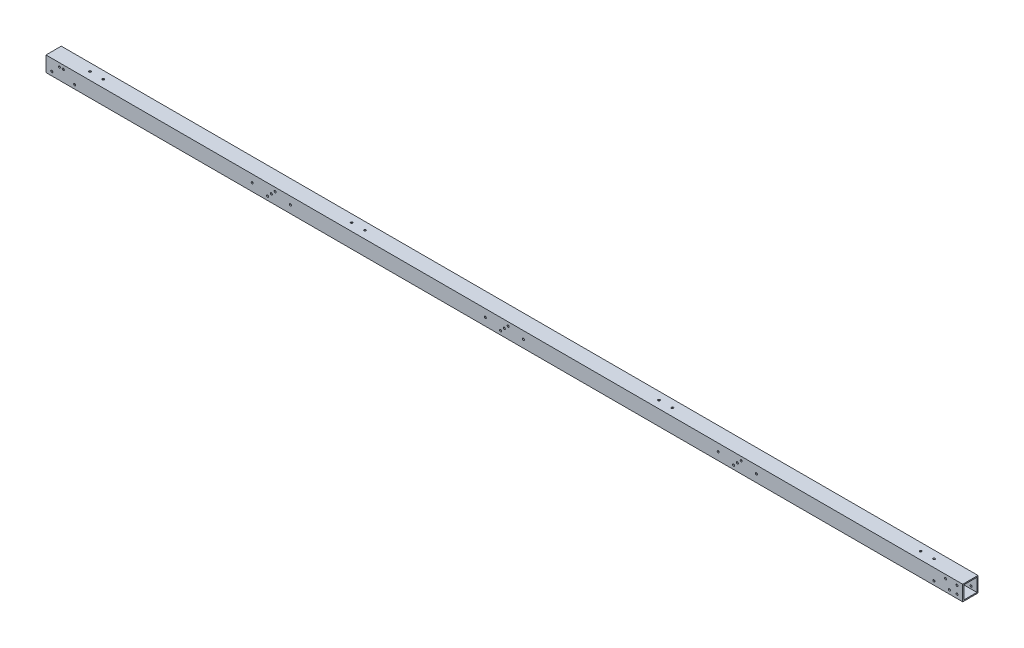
SolidWorks part; units mm, degrees
ref_plane "Front" through (0, 0, 0) normal (0, 0, 1) x (1, 0, 0)
ref_plane "Top" through (0, 0, 0) normal (0, 1, 0) x (1, 0, 0)
ref_plane "Right" through (0, 0, 0) normal (1, 0, 0) x (0, 0, -1)
sketch "Sketch1" plane through (0, 0, 0) normal (1, 0, 0) x (0, 0, -1)
  line L1 (0, 0) -> (50.8, 0)
  line L2 (0, 0) -> (0, 50.8)
  line L3 (0, 50.8) -> (50.8, 50.8)
  line L4 (50.8, 0) -> (50.8, 50.8)
  line L5 (3.6576, 47.1424) -> (47.1424, 47.1424)
  line L6 (3.6576, 47.1424) -> (3.6576, 3.6576)
  line L7 (3.6576, 3.6576) -> (47.1424, 3.6576)
  line L8 (47.1424, 47.1424) -> (47.1424, 3.6576)
  dimension "D1" = 50.8
  dimension "D2" = 50.8
  dimension "D3" = 3.6576
  dimension "D4" = 3.6576
  dimension "D5" = 3.6576
  dimension "D6" = 3.6576
extrude "Extrude1" add sketch "Sketch1" along normal blind 3048
sketch "Sketch3" plane through (0, 0, -50.8) normal (0, 0, -1) x (-1, 0, 0)
  line L5 (0, 0) -> (0, -664.0913) construction
  line L6 (0, -664.0913) -> (-3047.8384, -664.0913) construction
  line L7 (-3047.8384, 0) -> (-3047.8384, -664.0913) construction
  line L8 (-1523.9192, -664.0913) -> (-1523.9192, 171.6838) construction
  circle A0 centre (-95.6188, 12.3324) radius 3.3731
  circle A1 centre (-57.6849, 37.9799) radius 3.3731
  circle A2 centre (-3028.95, 12.7) radius 3.3731
  circle A4 centre (-19.4204, 12.8284) radius 3.3731
  circle A5 centre (-2952.2196, 12.3324) radius 3.3731
  circle A6 centre (-2990.85, 38.1) radius 3.3731
  point P0 (-3047.8384, 0)
extrude "Cut-Extrude2" cut sketch "Sketch3" against normal through all
sketch "Sketch4" plane through (0, 0, -50.8) normal (0, 0, -1) x (-1, 0, 0)
  circle A0 centre (-2235.1466, 25.4) radius 3.3731
  circle A1 centre (-2298.6466, 25.4) radius 3.3731
  circle A2 centre (-2362.1466, 25.4) radius 3.3731
  circle A3 centre (-812.7466, 25.4) radius 3.3731
  circle A4 centre (-749.2466, 25.4) radius 3.3731
  circle A5 centre (-685.7466, 25.4) radius 3.3731
  dimension "D1" = 6.7462
extrude "Cut-Extrude3" cut sketch "Sketch4" against normal through all
sketch "Sketch5" plane through (0, 0, -50.8) normal (0, 0, -1) x (-1, 0, 0)
  circle A0 centre (-1536.7, 38.1) radius 3.3731
  circle A1 centre (-1511.2466, 12.7) radius 3.3731
  dimension "D1" = 6.7462
sketch "Sketch6" plane through (0, 0, -50.8) normal (0, 0, -1) x (-1, 0, 0)
  circle A0 centre (-1524.0534, 25.4) radius 3.3731
  circle A1 centre (-1460.5534, 25.4) radius 3.3731
  circle A2 centre (-1587.5534, 25.4) radius 3.3731
  circle A3 centre (-736.6534, 12.7) radius 3.3731
  circle A4 centre (-762.0534, 38.1) radius 3.3731
  circle A5 centre (-2311.4534, 38.1) radius 3.3731
  circle A6 centre (-2286.0534, 12.7) radius 3.3731
  dimension "D1" = 6.7462
  dimension "D2" = 6.7462
  dimension "D3" = 6.7462
extrude "Cut-Extrude4" cut sketch "Sketch6" against normal through all
sketch "Sketch7" plane through (0, 0, -50.8) normal (0, 0, -1) x (-1, 0, 0)
  circle A0 centre (-1536.7, 38.1) radius 3.3731
  circle A1 centre (-1511.2466, 12.7) radius 3.3731
  dimension "D1" = 6.7462
  dimension "D2" = 6.7462
extrude "Cut-Extrude5" cut sketch "Sketch7" against normal through all
sketch "Sketch8" plane through (0, 0, 0) normal (0, 0, 1) x (1, 0, 0)
  line L0 (1524, 50.8) -> (1524, 207.5111) construction
  line L1 (3048, 50.8) -> (0, 50.8) construction
  circle A0 centre (95.25, 12.7) radius 3.304
  circle A1 centre (57.15, 38.1) radius 3.1902
  circle A2 centre (19.05, 12.7) radius 3.304
  circle A3 centre (3028.95, 12.7) radius 3.304
  circle A4 centre (2990.85, 38.1) radius 3.1902
  circle A5 centre (2952.75, 12.7) radius 3.304
extrude "Cut-Extrude6" cut sketch "Sketch8" against normal through all
sketch "Sketch9" plane through (0, 0, -50.8) normal (0, 0, -1) x (-1, 0, 0)
  circle A0 centre (-44.45, 38.1) radius 3.3731
  circle A1 centre (-3003.55, 12.7) radius 3.3731
  circle A2 centre (-3028.95, 38.1) radius 3.3731
  dimension "D1" = 6.7462
  dimension "D2" = 6.7462
extrude "Cut-Extrude7" cut sketch "Sketch9" against normal through all
sketch "Sketch11" plane through (0, 0, 0) normal (0, -1, 0) x (1, 0, 0)
  circle A0 centre (120.7217, -25.4) radius 3.3731
  circle A1 centre (165.0283, -25.4) radius 3.3731
  dimension "D1" = 6.7462
sketch "Sketch12" plane through (0, 0, 0) normal (0, -1, 0) x (1, 0, 0)
  circle A0 centre (165.0283, -25.4) radius 3.3731
  circle A1 centre (120.7217, -25.4) radius 3.3731
  circle A2 centre (1035.1217, -25.4) radius 3.3731
  circle A3 centre (990.8152, -25.4) radius 3.3731
  circle A4 centre (2057.2566, -25.4) radius 3.3731
  circle A5 centre (2012.95, -25.4) radius 3.3731
  circle A6 centre (2927.35, -25.4) radius 3.3731
  circle A7 centre (2882.9717, -25.4) radius 3.3731
  dimension "D1" = 6.7462
  dimension "D2" = 6.7462
  dimension "D3" = 6.7462
  dimension "D4" = 6.7462
  dimension "D5" = 6.7462
extrude "Cut-Extrude8" cut sketch "Sketch12" against normal through all
